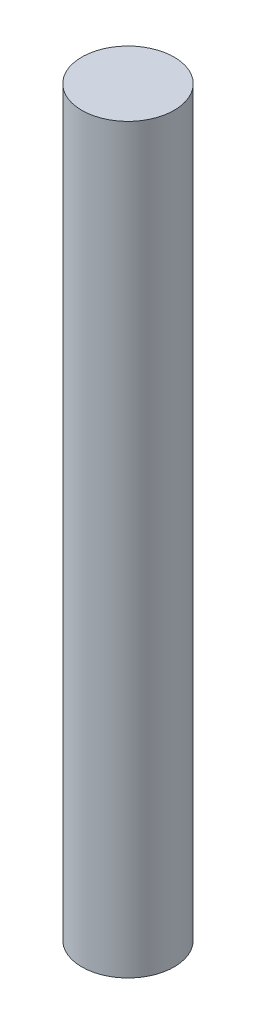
SolidWorks part; units mm, degrees
ref_plane "Alzado" through (0, 0, 0) normal (0, 0, 1) x (1, 0, 0)
ref_plane "Planta" through (0, 0, 0) normal (0, 1, 0) x (1, 0, 0)
ref_plane "Vista lateral" through (0, 0, 0) normal (1, 0, 0) x (0, 0, -1)
sketch "Croquis1" plane through (0, 0, 0) normal (0, 1, 0) x (1, 0, 0)
  circle A0 centre (0, 0) radius 28
  dimension "D1" = 56
extrude "Saliente-Extruir1" add sketch "Croquis1" along normal blind 450
sketch "Croquis2" plane through (0, 0, 0) normal (0, -1, 0) x (1, 0, 0)
  circle A2 centre (0, 0) radius 25
  circle A3 centre (0, 0) radius 25
  dimension "D1" = 3
extrude "Cortar-Extruir1" cut sketch "Croquis2" against normal blind 5 draft 42
